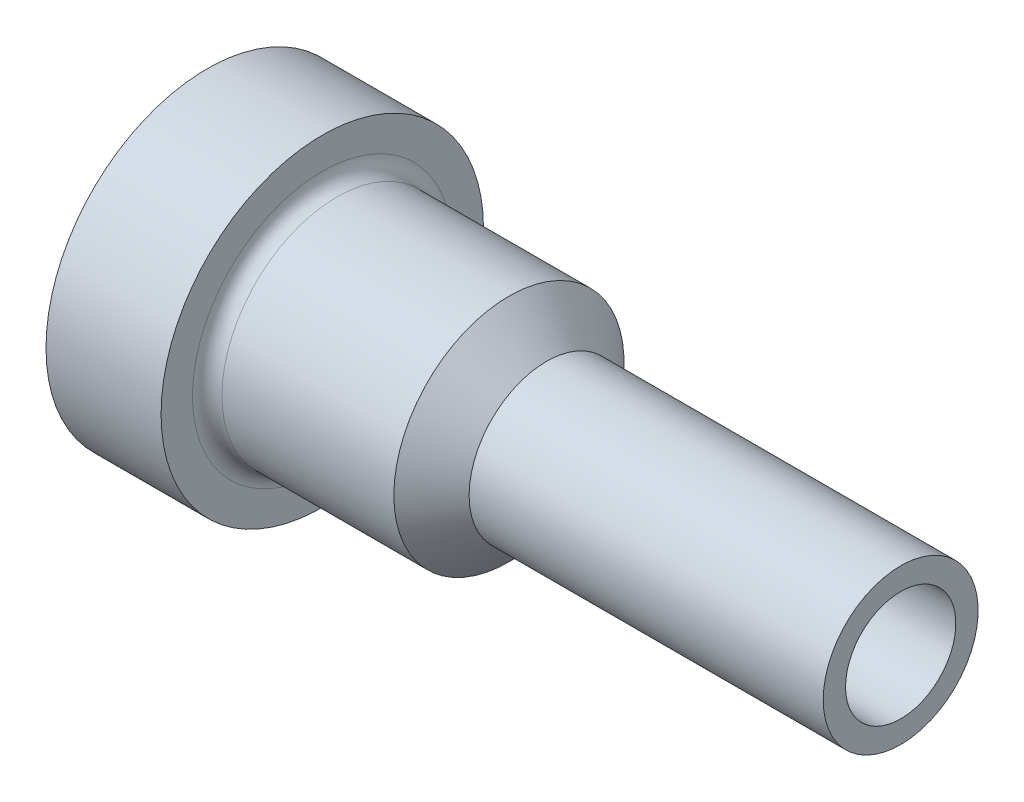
SolidWorks part; units mm, degrees
ref_plane "Front" through (0, 0, 0) normal (0, 0, 1) x (1, 0, 0)
ref_plane "Top" through (0, 0, 0) normal (0, 1, 0) x (1, 0, 0)
ref_plane "Right" through (0, 0, 0) normal (1, 0, 0) x (0, 0, -1)
sketch "Sketch1" plane through (0, 0, 0) normal (1, 0, 0) x (0, 0, -1)
  circle A0 centre (0, 0) radius 5.5499
  dimension "D1" = 11.0998
extrude "Base-Extrude" add sketch "Sketch1" along normal blind 23.876
sketch "Sketch2" plane through (0, 0, 0) normal (0, 0, 1) x (1, 0, 0)
  line L0 (0, 0) -> (8.4048, 0) construction
  line L1 (3.9624, 5.5499) -> (3.9624, 3.9624)
  line L2 (3.9624, 3.9624) -> (10.3886, 3.9624)
  line L3 (10.3886, 3.9624) -> (11.684, 2.667)
  line L4 (11.684, 2.667) -> (23.876, 2.667)
  line L5 (23.876, 2.667) -> (23.876, 5.5499)
  line L6 (23.876, 5.5499) -> (3.9624, 5.5499)
  line L7 (23.876, 5.5499) -> (0, 5.5499) construction
  line L8 (23.876, -5.5499) -> (23.876, 5.5499) construction
  line L9 (0, -55) -> (0, 55) construction
  dimension "D1" = 3.9624
  dimension "D2" = 7.9248
  dimension "D3" = 5.334
  dimension "D4" = 11.684
  dimension "D5" = 45
revolve "Cut-Revolve1" cut sketch "Sketch2" angle 360 about L0
hole_wizard "#10-24 Tapped Hole1" positions "Sketch4" profile "Sketch3"
sketch "Sketch4" plane through (0, 0, 0) normal (-1, 0, 0) x (0, 0, 1)
  point P0 (0, 0)
sketch "Sketch3" plane through (0, 0, 0) normal (0, 1, 0) x (0, 0, 1)
  line L0 (0, 0) -> (0, 23.876)
  line L1 (0, 23.876) -> (1.8986, 23.876)
  line L2 (1.8986, 23.876) -> (1.8986, 0)
  line L5 (1.8986, 0) -> (0, 0)
  line L11 (0, -6.35) -> (0, 107.95) construction
  dimension "Thru Hole Dia." = 3.7973
  dimension "Thru Hole Depth" = 23.876
chamfer "Chamfer1" distance 0.762 angle 42 1 edges at (0, 0, 1.8986)
fillet "Fillet1" radius 0.508 1 edges at (3.9624, 0, 3.9624)
